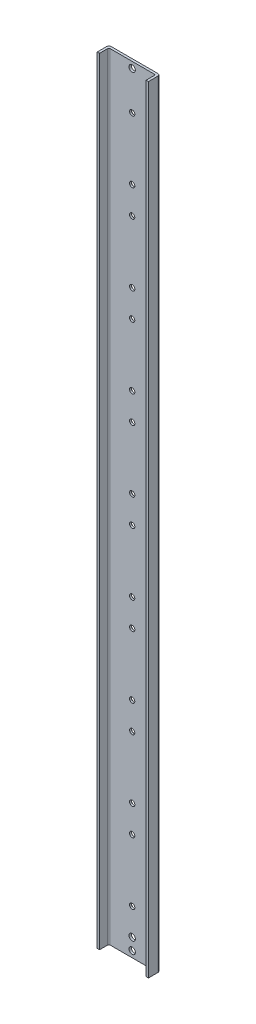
SolidWorks part; units mm, degrees
ref_plane "Front Plane" through (0, 0, 0) normal (0, 0, 1) x (1, 0, 0)
ref_plane "Top Plane" through (0, 0, 0) normal (0, 1, 0) x (1, 0, 0)
ref_plane "Right Plane" through (0, 0, 0) normal (1, 0, 0) x (0, 0, -1)
sketch "Sketch1" plane through (0, 0, 0) normal (0, 1, 0) x (1, 0, 0)
  line L1 (-33, -7.5) -> (33, -7.5)
  line L2 (-33, -7.5) -> (-33, 7.5)
  line L3 (-33, 7.5) -> (33, 7.5)
  line L4 (33, -7.5) -> (33, 7.5)
  line L5 (-33, -7.5) -> (33, 7.5) construction
  line L6 (-33, 7.5) -> (33, -7.5) construction
  point P0 (0, 0)
  dimension "D1" = 66
  dimension "D2" = 15
extrude "Boss-Extrude1" add sketch "Sketch1" along normal mid plane 1000
sketch "Sketch2" plane through (0, -500, 0) normal (0, -1, 0) x (1, 0, 0)
  line L1 (30, 7.5) -> (30, -4.5)
  line L2 (-33, 7.5) -> (33, 7.5) construction
  line L3 (30, -4.5) -> (-30, -4.5)
  line L4 (-30, -4.5) -> (-30, 7.5)
  line L6 (33, 7.5) -> (33, -7.5) construction
  line L7 (33, -7.5) -> (-33, -7.5) construction
  line L8 (-33, -7.5) -> (-33, 7.5) construction
  line L9 (30, 7.5) -> (-30, 7.5)
  dimension "D1" = 3
  dimension "D2" = 3
  dimension "D3" = 3
extrude "Cut-Extrude1" cut sketch "Sketch2" against normal through all
fillet "Fillet1" radius 3 2 edges at (-33, 0, -7.5) (33, 0, -7.5)
fillet "Fillet2" radius 1.5 2 edges at (-30, 0, -4.5) (30, 0, -4.5)
sketch "Sketch4" plane through (0, 0, -7.5) normal (0, 0, -1) x (-1, 0, 0)
  line L0 (0, -500) -> (0, 500) construction
  line L1 (30, 0) -> (-30, 0) construction
  line L4 (-30, -500) -> (30, -500)
  line L5 (30, -500) -> (30, 500)
  line L6 (30, 500) -> (-30, 500)
  line L7 (-30, 500) -> (-30, -500)
  line L8 (-30, -500) -> (30, -500)
  line L9 (30, -500) -> (30, 500)
  line L10 (30, 500) -> (-30, 500)
  line L11 (-30, 500) -> (-30, -500)
  point P8 (0, 0)
  point P9 (0, 57.5)
  point P10 (0, 172.5)
  point P11 (0, 287.5)
  point P12 (0, 402.5)
  point P13 (0, -57.5)
  point P14 (0, -172.5)
  point P15 (0, -287.5)
  point P16 (0, -402.5)
  point P17 (0, -442.5)
  point P18 (0, -362.5)
  point P19 (0, -327.5)
  point P20 (0, -247.5)
  point P21 (0, -212.5)
  point P22 (0, -132.5)
  point P23 (0, -97.5)
  point P24 (0, -17.5)
  point P25 (0, 17.5)
  point P26 (0, 97.5)
  point P27 (0, 132.5)
  point P28 (0, 212.5)
  point P29 (0, 247.5)
  point P30 (0, 327.5)
  point P31 (0, 362.5)
  point P32 (0, 442.5)
  dimension "D2" = 57.5
  dimension "D3" = 115
  dimension "D4" = 115
  dimension "D5" = 115
  dimension "D6" = 57.5
  dimension "D7" = 115
  dimension "D8" = 115
  dimension "D9" = 115
  dimension "D10" = 40
  dimension "D11" = 40
  dimension "D12" = 40
  dimension "D13" = 40
  dimension "D14" = 40
  dimension "D15" = 40
  dimension "D16" = 40
  dimension "D17" = 40
  dimension "D18" = 40
  dimension "D19" = 40
  dimension "D20" = 40
  dimension "D21" = 40
  dimension "D22" = 40
  dimension "D23" = 40
  dimension "D24" = 40
  dimension "D25" = 40
  dimension "D1" = 0
hole_wizard "M8 Tapped Hole1" positions "Sketch5" profile "Sketch6" tap size "M8" standard "ISO"
sketch "Sketch5" plane through (0, 0, -7.5) normal (0, 0, -1) x (-1, 0, 0)
  point P24 (0, 442.5)
  point P27 (0, 362.5)
  point P30 (0, 327.5)
  point P33 (0, 247.5)
  point P37 (0, 212.5)
  point P40 (0, 132.5)
  point P43 (0, 97.5)
  point P46 (0, 17.5)
  point P50 (0, -17.5)
  point P53 (0, -97.5)
  point P56 (0, -132.5)
  point P59 (0, -212.5)
  point P62 (0, -247.5)
  point P65 (0, -327.5)
  point P68 (0, -362.5)
  point P71 (0, -442.5)
sketch "Sketch6" plane through (0, 442.5, -7.5) normal (1, 0, 0) x (0, 1, 0)
  line L0 (0, 0) -> (0, 3)
  line L1 (0, 3) -> (3.4, 3)
  line L2 (3.4, 3) -> (3.4, 0.625)
  line L3 (3.4, 0.625) -> (4.025, 0)
  line L5 (4.025, 0) -> (0, 0)
  line L6 (-3.4, 0.625) -> (-4.025, 0) construction
  line L11 (0, -6.35) -> (0, 107.95) construction
  dimension "Thru Tap Drill Dia." = 6.8
  dimension "Thru Tap Drill Depth" = 3
  dimension "Near C'Sink Dia." = 8.05
  dimension "Near C'Sink Angle" = 90
sketch "Sketch7" plane through (0, 0, -7.5) normal (0, 0, -1) x (-1, 0, 0)
  line L0 (-30, -500) -> (30, -500) construction
  line L1 (30, -500) -> (30, 500) construction
  circle A0 centre (0, -492) radius 4.1
  circle A1 centre (0, -477) radius 4.1
  dimension "D1" = 8.2
  dimension "D2" = 8.2
  dimension "D3" = 8
  dimension "D4" = 15
  dimension "D5" = 30
  dimension "D6" = 30
extrude "Cut-Extrude2" cut sketch "Sketch7" against normal blind 10
sketch "Sketch8" plane through (0, 0, -7.5) normal (0, 0, -1) x (-1, 0, 0)
  line L0 (-30, 500) -> (30, 500) construction
  line L1 (30, -500) -> (30, 500) construction
  circle A0 centre (0, 492) radius 4.1
  dimension "D1" = 8.2
  dimension "D2" = 8
  dimension "D3" = 30
extrude "Cut-Extrude3" cut sketch "Sketch8" against normal blind 10
